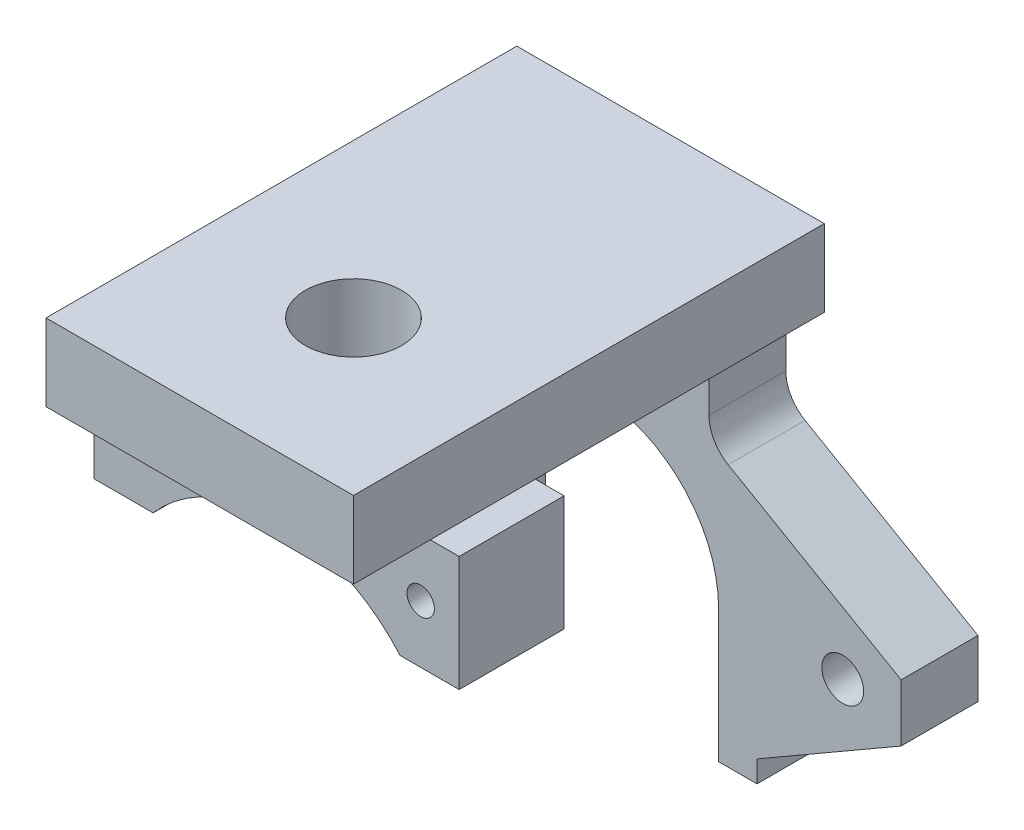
SolidWorks part; units mm, degrees
ref_plane "Front Plane" through (0, 0, 0) normal (0, 0, 1) x (1, 0, 0)
ref_plane "Top Plane" through (0, 0, 0) normal (0, 1, 0) x (1, 0, 0)
ref_plane "Right Plane" through (0, 0, 0) normal (1, 0, 0) x (0, 0, -1)
sketch "Sketch1" plane through (0, 0, 0) normal (1, 0, 0) x (0, 0, -1)
  line L0 (0, 0) -> (-81.788, 0)
  line L1 (0, 0) -> (0, -36.5125)
  line L2 (-6.35, -6.35) -> (-81.788, -6.35)
  line L3 (-6.35, -6.35) -> (-6.35, -36.5125)
  line L4 (-81.788, -6.35) -> (-81.788, 0)
  line L5 (-6.35, -36.5125) -> (0, -36.5125)
  dimension "D2" = 81.788
  dimension "D3" = 36.5125
  dimension "D1" = 6.35
extrude "Extrude1" add sketch "Sketch1" along normal mid plane 50.8
sketch "Sketch2" plane through (0, 0, 0) normal (0, 0, -1) x (-1, 0, 0)
  line L0 (-25.4, 0) -> (25.4, 0) construction
  line L1 (-10.3187, -25.5016) -> (-10.3187, -41.3766)
  line L2 (10.3187, -25.5016) -> (10.3187, -41.3766)
  line L3 (10.3187, -41.3766) -> (-10.3187, -41.3766)
  arc A0 (10.3187, -25.5016) -> (-10.3187, -25.5016) centre (0, -25.5016) ccw
  dimension "D2" = 10.3187
  dimension "D1" = 25.5016
extrude "Cut-Extrude1" cut sketch "Sketch2" against normal up to next
sketch "Sketch6" plane through (0, -6.35, 0) normal (0, -1, 0) x (1, 0, 0)
  line L0 (25.4, 6.35) -> (10.3187, 6.35) construction
  line L1 (25.4, 81.788) -> (12.7, 81.788)
  line L2 (25.4, 81.788) -> (25.4, 6.35)
  line L3 (25.4, 6.35) -> (12.7, 6.35)
  line L4 (12.7, 81.788) -> (12.7, 6.35)
  line L5 (25.4, 6.35) -> (-25.4, 6.35) construction
  line L6 (-25.4, 81.788) -> (-12.7, 81.788)
  line L7 (-25.4, 81.788) -> (-25.4, 6.35)
  line L8 (-25.4, 6.35) -> (-12.7, 6.35)
  line L9 (-12.7, 81.788) -> (-12.7, 6.35)
  dimension "D1" = 12.7
  dimension "D2" = 12.7
  dimension "D3" = 25.4
extrude "Cut-Extrude2" cut sketch "Sketch6" against normal through all
sketch "Sketch7" plane through (12.7, 0, 0) normal (1, 0, 0) x (0, 0, -1)
  line L0 (-81.788, -6.35) -> (-6.35, -6.35) construction
  line L1 (-23.8696, -6.35) -> (-32.5437, -6.35)
  line L2 (-23.8696, -6.35) -> (-23.8696, -15.875)
  line L3 (-23.8696, -15.875) -> (-32.5437, -15.875)
  line L4 (-32.5437, -6.35) -> (-32.5437, -15.875)
  line L5 (0, -36.5125) -> (0, 0) construction
  dimension "D1" = 9.525
  dimension "D2" = 8.6741
  dimension "D3" = 32.5438
extrude "Extrude2" add sketch "Sketch7" against normal blind 27.7812 and the other way blind 2.3812
sketch "Sketch11" plane through (0, 0, 32.5437) normal (0, 0, 1) x (1, 0, 0)
  circle A0 centre (0, -24.7079) radius 13.4938
  arc A1 (10.3188, -25.5016) -> (-10.3187, -25.5016) centre (0, -25.5016) ccw construction
  dimension "D1" = 13.4937
  dimension "D2" = 0.7937
extrude "Cut-Extrude4" cut sketch "Sketch11" against normal up to next
hole_wizard "#4-40 Tapped Hole1" positions "Sketch16" profile "Sketch15" tap size "#4-40" standard "ANSI Inch"
sketch "Sketch16" plane through (0, 0, 32.5437) normal (0, 0, 1) x (1, 0, 0)
  line L0 (-12.7, -6.35) -> (12.7, -6.35) construction
  point P0 (-11.9062, -11.1125)
  point P1 (11.9063, -11.1125)
  dimension "D1" = 4.7625
  dimension "D2" = 11.9062
  dimension "D3" = 11.9062
sketch "Sketch15" plane through (-11.9063, -11.1125, 32.5437) normal (1, 0, 0) x (0, -1, 0)
  line L0 (0, 0) -> (0, 8.6741)
  line L1 (0, 8.6741) -> (1.1303, 8.6741)
  line L2 (1.1303, 8.6741) -> (1.1303, 0)
  line L5 (1.1303, 0) -> (0, 0)
  line L11 (0, -6.35) -> (0, 107.95) construction
  dimension "Thru Tap Drill Dia." = 2.2606
  dimension "Thru Tap Drill Depth" = 8.6741
hole_wizard "#8-32 Tapped Hole4" positions "3DSketch1" profile "Sketch3" tap size "#8-32" standard "Ansi Inch"
sketch3d "3DSketch1"
  line L0 (25.4, 0, 0) -> (-25.4, 0, 0) construction
  circle A0 centre (0, -25.5016, 0) radius 10.3187 construction
  point P0 (20.574, -25.4889, 0)
  point P2 (-20.574, -25.4889, 0)
  point P11 (0, -25.5016, -10.3188)
  dimension "D1" = 41.148
  dimension "D2" = 25.4889
  dimension "D3" = 20.574
sketch "Sketch3" plane through (20.574, -25.4889, 0) normal (1, 0, 0) x (0, 1, 0)
  line L0 (0, 0) -> (0, 6.7754)
  line L1 (0, 6.7754) -> (1.7272, 6.7754)
  line L2 (1.7272, 6.7754) -> (1.7272, 0)
  line L5 (1.7272, 0) -> (0, 0)
  line L10 (0, 6.7754) -> (-1.7272, 6.7754) construction
  line L11 (0, -6.35) -> (0, 107.95) construction
  dimension "Tap Drill Dia." = 3.4544
  dimension "Tap Drill Depth" = 6.7754
  dimension "Drill Angle" = 180
sketch "Sketch8" plane through (0, -15.875, 0) normal (0, -1, 0) x (1, 0, 0)
  circle A0 centre (0, 26.1937) radius 3.9688
  dimension "D1" = 7.9375
  dimension "D2" = 26.1937
extrude "Cut-Extrude3" cut sketch "Sketch8" against normal up to next
hole_wizard "#8-32 Tapped Hole2" positions "3DSketch5" profile "Sketch10" tap size "#8-32" standard "Ansi Inch"
sketch3d "3DSketch5"
  line L0 (25.4, 0, 0) -> (-25.4, 0, 0) construction
  line L1 (0, 0, 0) -> (0, 0, 81.788) construction
  line L2 (13.4937, 0, 81.788) -> (-13.4938, 0, 81.788) construction
  point P0 (-6.35, 0, 36.957)
  point P2 (6.35, 0, 36.957)
  point P4 (6.35, 0, 75.7428)
  point P6 (-6.35, 0, 75.7428)
  dimension "D1" = 36.957
  dimension "D2" = 38.7858
  dimension "D3" = 6.35
  dimension "D4" = 12.7
sketch "Sketch10" plane through (-6.35, 0, 36.957) normal (1, 0, 0) x (0, 0, 1)
  line L0 (0, 0) -> (0, 6.35)
  line L1 (0, 6.35) -> (1.7272, 6.35)
  line L2 (1.7272, 6.35) -> (1.7272, 0)
  line L5 (1.7272, 0) -> (0, 0)
  line L11 (0, -6.35) -> (0, 107.95) construction
  dimension "Thru Tap Drill Dia." = 3.4544
  dimension "Thru Tap Drill Depth" = 6.35
hole_wizard "#10-32 Tapped Hole1" positions "Sketch14" profile "Sketch13" tap size "#10-32" standard "Ansi Inch"
sketch "Sketch14" plane through (0, 0, 0) normal (0, 1, 0) x (-1, 0, 0)
  line L0 (-12.7, 81.788) -> (12.7, 81.788) construction
  point P0 (0, 72.263)
  point P1 (0, 50.038)
  dimension "D1" = 9.525
  dimension "D2" = 22.225
sketch "Sketch13" plane through (0, 0, 72.263) normal (1, 0, 0) x (0, 0, 1)
  line L0 (0, 0) -> (0, 36.5125)
  line L1 (0, 36.5125) -> (2.0193, 36.5125)
  line L2 (2.0193, 36.5125) -> (2.0193, 0)
  line L5 (2.0193, 0) -> (0, 0)
  line L11 (0, -6.35) -> (0, 107.95) construction
  dimension "Thru Tap Drill Dia." = 4.0386
  dimension "Thru Tap Drill Depth" = 36.5125
sketch "Sketch12" plane through (0, 0, 0) normal (0, 0, 1) x (1, 0, 0)
  line L0 (12.7, 0) -> (12.7, -6.35) construction
  line L1 (12.7, 0) -> (12.7, -6.35)
  line L2 (25.4, -27.8511) -> (13.4938, -34.7252)
  line L3 (9.525, -9.525) -> (9.525, -12.1189)
  line L4 (12.7, 0) -> (25.4, 0)
  line L5 (25.4, 0) -> (25.4, -23.1175)
  line L6 (0, 0) -> (0, 8.2533) construction
  line L7 (-13.4938, -34.7252) -> (-13.4937, -36.5125)
  line L8 (-25.4, -36.5125) -> (-25.4, -27.8511)
  line L9 (-13.4937, -36.5125) -> (-25.4, -36.5125)
  line L10 (-25.4, -23.1175) -> (-11.1125, -14.8686)
  line L11 (25.4, -23.1175) -> (11.1125, -14.8686)
  line L12 (25.4, -36.5125) -> (25.4, 0) construction
  line L14 (13.4937, -36.5125) -> (25.4, -36.5125)
  line L15 (25.4, -36.5125) -> (25.4, -27.8511)
  line L16 (13.4938, -34.7252) -> (13.4937, -36.5125)
  line L18 (-12.7, 0) -> (-25.4, 0)
  line L19 (-25.4, -27.8511) -> (-13.4938, -34.7252)
  line L20 (-12.7, 0) -> (-12.7, -6.35)
  line L23 (-9.525, -9.525) -> (-9.525, -12.1189)
  line L24 (-25.4, 0) -> (-25.4, -23.1175)
  arc A0 (-9.525, -9.525) -> (-12.7, -6.35) centre (-12.7, -9.525) ccw
  arc A1 (11.1125, -14.8686) -> (9.525, -12.1189) centre (12.7, -12.1189) cw
  circle A3 centre (20.574, -25.4889) radius 1.7272 construction
  arc A4 (9.525, -9.525) -> (12.7, -6.35) centre (12.7, -9.525) cw
  arc A5 (-11.1125, -14.8686) -> (-9.525, -12.1189) centre (-12.7, -12.1189) ccw
  dimension "D1" = 6.35
  dimension "D3" = 120
  dimension "D2" = 9.525
  dimension "D5" = 2.3714
  dimension "D6" = 2.3622
  dimension "D7" = 3.175
  dimension "D8" = 3.175
  dimension "D4" = 30
extrude "Cut-Extrude5" cut sketch "Sketch12" along normal up to next
sketch "Sketch17" plane through (0, -6.35, 0) normal (0, -1, 0) x (1, 0, 0)
  line L0 (-12.7, 32.5437) -> (-12.7, 81.788) construction
  line L1 (-12.7, 38.8937) -> (12.7, 38.8937)
  line L2 (-12.7, 38.8937) -> (-12.7, 81.788)
  line L3 (-12.7, 81.788) -> (12.7, 81.788)
  line L4 (12.7, 38.8937) -> (12.7, 81.788)
  line L5 (12.7, 81.788) -> (-12.7, 81.788) construction
  line L6 (-15.0812, 38.8937) -> (15.0813, 38.8937) construction
extrude "Cut-Extrude6" cut sketch "Sketch17" against normal blind 78.74
